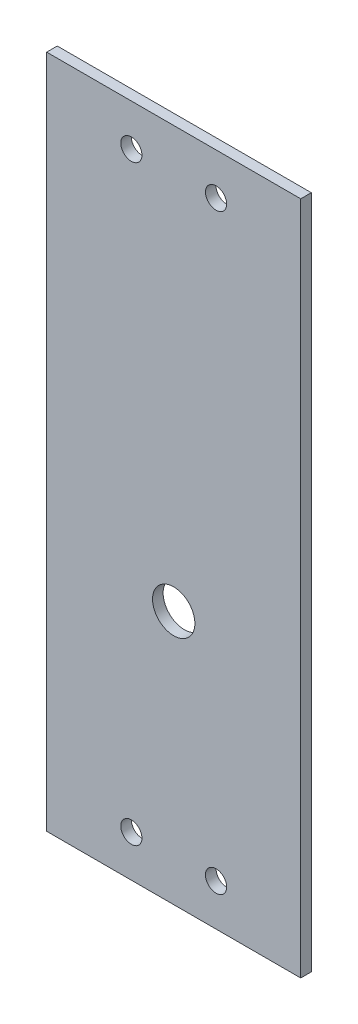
SolidWorks part; units mm, degrees
ref_plane "Front Plane" through (0, 0, 0) normal (0, 0, 1) x (1, 0, 0)
ref_plane "Top Plane" through (0, 0, 0) normal (0, 1, 0) x (1, 0, 0)
ref_plane "Right Plane" through (0, 0, 0) normal (1, 0, 0) x (0, 0, -1)
sketch "Sketch1" plane through (0, 0, 0) normal (0, 0, 1) x (1, 0, 0)
  line L0 (0, 0) -> (0, -202.4)
  line L1 (0, -202.4) -> (76.2, -202.4)
  line L2 (76.2, -202.4) -> (76.2, 0)
  line L3 (76.2, 0) -> (0, 0)
  dimension "D1" = 76.2
  dimension "D2" = 202.4
extrude "Boss-Extrude1" add sketch "Sketch1" along normal blind 3.175
sketch "Sketch2" plane through (0, 0, 3.175) normal (0, 0, 1) x (1, 0, 0)
  line L0 (0, 0) -> (0, -202.4) construction
  line L1 (76.2, -202.4) -> (76.2, 0) construction
  line L2 (76.2, 0) -> (0, 0) construction
  line L3 (0, -101.2) -> (76.2, -101.2) construction
  line L4 (0, -202.4) -> (76.2, -202.4) construction
  circle A0 centre (25.4, -12.5) radius 3.175
  circle A1 centre (50.8, -12.5) radius 3.175
  circle A2 centre (50.8, -189.9) radius 3.175
  circle A3 centre (25.4, -189.9) radius 3.175
  circle A4 centre (38.1, -126.2) radius 6.35
  point P18 (38.1, -101.2)
  dimension "D1" = 6.35
  dimension "D2" = 6.35
  dimension "D7" = 12.7
  dimension "D3" = 25.4
  dimension "D4" = 25.4
  dimension "D5" = 12.5
  dimension "D6" = 12.5
  dimension "D8" = 76.2
extrude "Cut-Extrude1" cut sketch "Sketch2" against normal up to surface (3.175 mm away)
